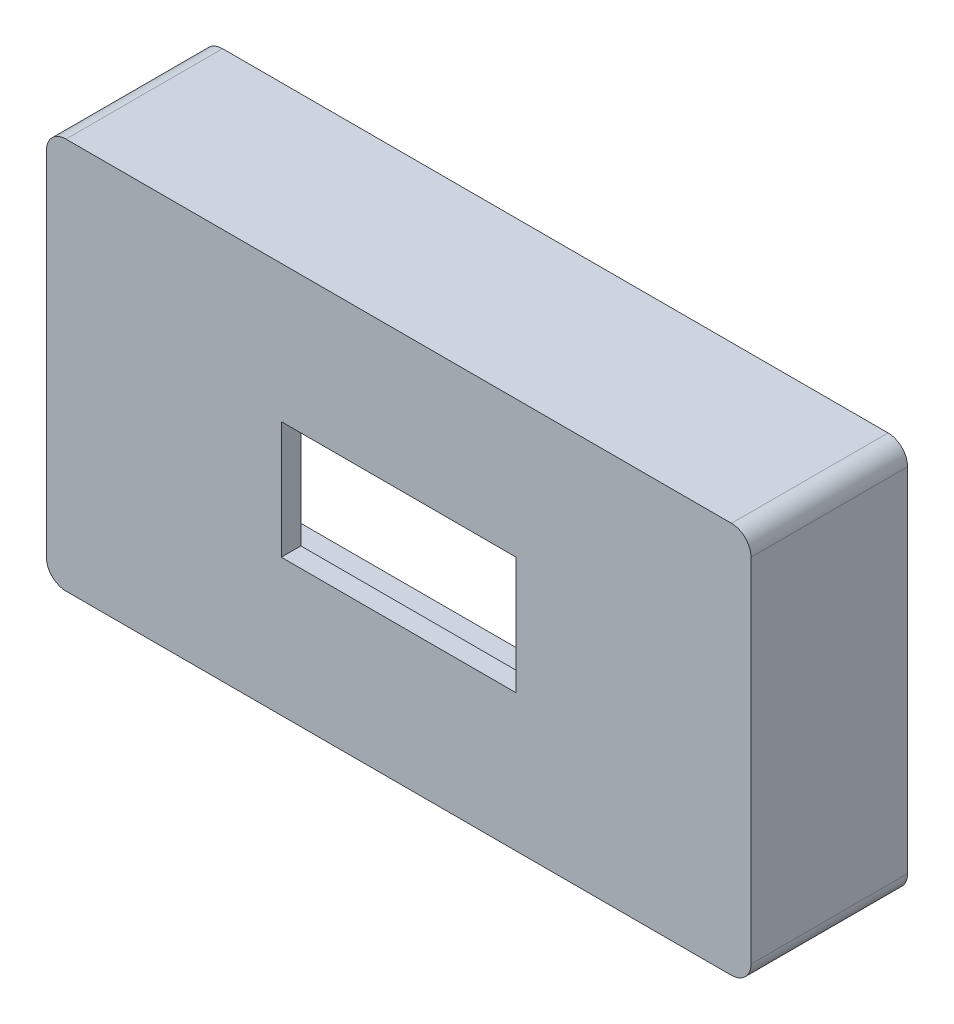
SolidWorks part; units mm, degrees
ref_plane "Front Plane" through (0, 0, 0) normal (0, 0, 1) x (1, 0, 0)
ref_plane "Top Plane" through (0, 0, 0) normal (0, 1, 0) x (1, 0, 0)
ref_plane "Right Plane" through (0, 0, 0) normal (1, 0, 0) x (0, 0, -1)
sketch "Sketch1" plane through (0, 0, 0) normal (0, 0, 1) x (1, 0, 0)
  line L1 (-43.18, 25.4) -> (43.18, 25.4)
  line L2 (-45.72, 22.86) -> (-45.72, -22.86)
  line L3 (-43.18, -25.4) -> (43.18, -25.4)
  line L4 (45.72, 22.86) -> (45.72, -22.86)
  line L5 (-45.72, 25.4) -> (45.72, -25.4) construction
  line L6 (-45.72, -25.4) -> (45.72, 25.4) construction
  line L7 (-15.24, 7.62) -> (15.24, 7.62)
  line L8 (-15.24, 7.62) -> (-15.24, -7.62)
  line L9 (-15.24, -7.62) -> (15.24, -7.62)
  line L10 (15.24, 7.62) -> (15.24, -7.62)
  line L11 (-15.24, 7.62) -> (15.24, -7.62) construction
  line L12 (-15.24, -7.62) -> (15.24, 7.62) construction
  arc A0 (43.18, 25.4) -> (45.72, 22.86) centre (43.18, 22.86) cw
  arc A1 (43.18, -25.4) -> (45.72, -22.86) centre (43.18, -22.86) ccw
  arc A2 (-45.72, -22.86) -> (-43.18, -25.4) centre (-43.18, -22.86) ccw
  arc A3 (-43.18, 25.4) -> (-45.72, 22.86) centre (-43.18, 22.86) ccw
  point P0 (0, 0)
  point P18 (0, 0)
  dimension "D3" = 2.54
  dimension "D1" = 91.44
  dimension "D2" = 50.8
  dimension "D4" = 15.24
  dimension "D5" = 30.48
extrude "Boss-Extrude1" add sketch "Sketch1" along normal blind 20.32
shell "Shell1" thickness 2.54
sketch "Sketch2" plane through (0, -10.16, 0) normal (0, -1, 0) x (1, 0, 0)
  line L0 (-17.78, 17.78) -> (17.78, 17.78) construction
  line L1 (-13.7468, 17.78) -> (17.78, 17.78)
  line L2 (-13.7468, 17.78) -> (-13.7468, 0)
  line L3 (-13.7468, 0) -> (17.78, 0)
  line L4 (17.78, 17.78) -> (17.78, 0)
  line L5 (-13.7468, 17.78) -> (17.78, 0) construction
  line L6 (-13.7468, 0) -> (17.78, 17.78) construction
  point P0 (2.0166, 8.89)
  dimension "D1" = 31.5268
extrude "Cut-Extrude1" cut sketch "Sketch2" against normal up to surface (33.02 mm away)
ref_plane "Plane1" through (0, 0, 0) normal (0, -1, 0) x (-1, 0, 0)
sketch "Sketch3" plane through (-17.78, 0, 0) normal (-1, 0, 0) x (0, 0, 1)
  line L0 (17.78, 10.16) -> (0, 10.16) construction
  line L1 (17.78, 10.16) -> (0, 10.16)
  line L2 (17.78, 10.16) -> (17.78, -10.16)
  line L3 (17.78, -10.16) -> (0, -10.16)
  line L4 (0, 10.16) -> (0, -10.16)
  line L5 (17.78, 10.16) -> (0, -10.16) construction
  line L6 (17.78, -10.16) -> (0, 10.16) construction
  line L8 (17.78, 10.16) -> (17.78, -10.16) construction
  point P0 (8.89, 0)
extrude "Cut-Extrude3" cut sketch "Sketch3" against normal up to surface (60.96 mm away)
sketch "Sketch4" plane through (43.18, 0, 0) normal (-1, 0, 0) x (0, 0, 1)
  line L1 (0, 22.86) -> (17.78, 22.86)
  line L2 (0, 22.86) -> (0, -22.86)
  line L3 (0, -22.86) -> (17.78, -22.86)
  line L4 (17.78, 22.86) -> (17.78, -22.86)
extrude "Boss-Extrude2" add sketch "Sketch4" along normal blind 7.62
ref_plane "Plane2" through (0, 0, 0) normal (1, 0, 0) x (0, 0, -1)
mirror "Mirror1" about plane through (0, 0, 0) normal (1, 0, 0) of "Boss-Extrude2"
